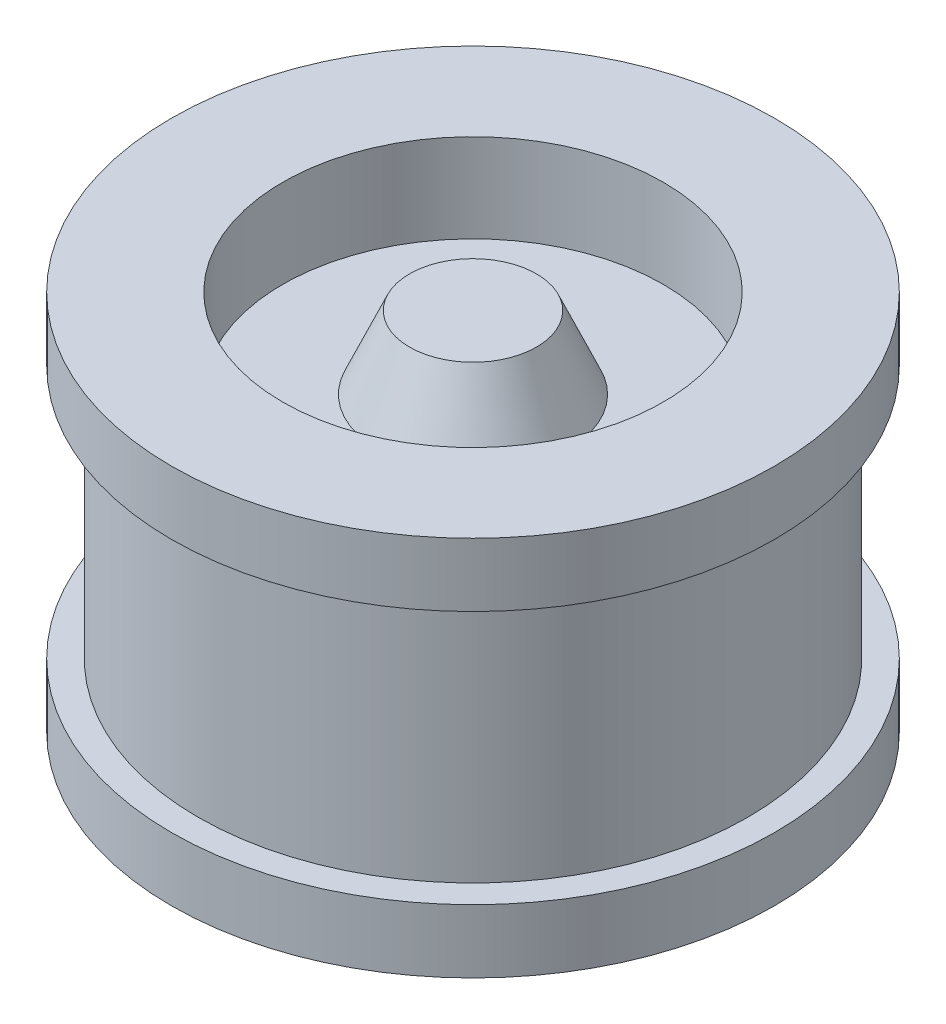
SolidWorks part; units mm, degrees
ref_plane "Plan1" through (0, 0, 0) normal (0, 0, 1) x (1, 0, 0)
ref_plane "Plan2" through (0, 0, 0) normal (0, 1, 0) x (1, 0, 0)
ref_plane "Plan3" through (0, 0, 0) normal (1, 0, 0) x (0, 0, -1)
sketch "Esquisse1" plane through (0, 0, 0) normal (0, 0, 1) x (1, 0, 0)
  line L0 (0, 50) -> (0, -50) construction
  line L1 (0, 0) -> (3, 0)
  line L2 (3, 0) -> (3, 8)
  line L3 (3, 8) -> (6.5, 8)
  line L4 (6.5, 8) -> (6.5, 2)
  line L5 (6.5, 2) -> (9.5, 2)
  line L6 (9.5, 2) -> (9.5, 4)
  line L7 (9.5, 4) -> (8.6625, 4)
  line L8 (8.6625, 4) -> (8.6625, 12)
  line L9 (8.6625, 12) -> (9.5, 12)
  line L10 (9.5, 12) -> (9.5, 14)
  line L11 (9.5, 14) -> (5.9994, 14)
  line L12 (5.9994, 14) -> (5.9994, 11.2121)
  line L13 (5.9994, 11.2121) -> (3, 11.2121)
  line L14 (2, 13.5) -> (3, 11.2121)
  line L15 (2, 13.5) -> (0, 13.5)
  line L16 (0, 13.5) -> (0, 0)
  line L17 (0, 20) -> (0, 0) construction
  point P17 (20, 30)
  point P18 (2, 13.5)
  dimension "D1" = 3
  dimension "D2" = 8
  dimension "D3" = 3.5
  dimension "D4" = 3
  dimension "D5" = 4
  dimension "D6" = 8
  dimension "D7" = 2
  dimension "D8" = 3.5006
  dimension "D9" = 2.9994
  dimension "D10" = 13.5
  dimension "D11" = 2
  dimension "D12" = 2
revolve "Base-Révolution" add sketch "Esquisse1" angle 360 about L17
sketch "Esquisse2" plane through (0, 0, 0) normal (0, -1, 0) x (1, 0, 0)
  circle A0 centre (0, 0) radius 1
  dimension "D1" = 2
extrude "Enlèv. mat.-Extru.1" cut sketch "Esquisse2" against normal blind 5.5
chamfer "Chanfrein1" distance 0.25 angle 45
sketch "Esquisse5" plane through (0, 8, 0) normal (0, -1, 0) x (1, 0, 0)
  line L0 (6.4807, -0.5) -> (2.958, -0.5)
  line L1 (6.4807, 0.5) -> (2.958, 0.5)
  line L2 (0.5, 6.4807) -> (0.5, 2.958)
  line L3 (-0.5, 6.4807) -> (-0.5, 2.958)
  line L5 (-0.5, -2.958) -> (-0.5, -6.4807)
  line L6 (-2.958, 0.5) -> (-6.4807, 0.5)
  line L7 (-2.958, -0.5) -> (-6.4807, -0.5)
  line L8 (0.5, -2.958) -> (0.5, -6.4807)
  arc A0 (2.958, -0.5) -> (2.958, 0.5) centre (0, 0) ccw
  arc A1 (6.4807, -0.5) -> (6.4807, 0.5) centre (0, 0) ccw
  arc A2 (-0.5, -6.4807) -> (0.5, -6.4807) centre (0, 0) ccw
  arc A3 (-6.4807, 0.5) -> (-6.4807, -0.5) centre (0, 0) ccw
  arc A4 (0.5, 6.4807) -> (-0.5, 6.4807) centre (0, 0) ccw
  arc A5 (-0.5, -2.958) -> (0.5, -2.958) centre (0, 0) ccw
  arc A6 (-2.958, 0.5) -> (-2.958, -0.5) centre (0, 0) ccw
  arc A7 (0.5, 2.958) -> (-0.5, 2.958) centre (0, 0) ccw
  dimension "D1" = 0.5
  dimension "D2" = 1
  dimension "D3" = 0.5
  dimension "D4" = 1
extrude "Boss.-Extru.1" add sketch "Esquisse5" along normal blind 4
